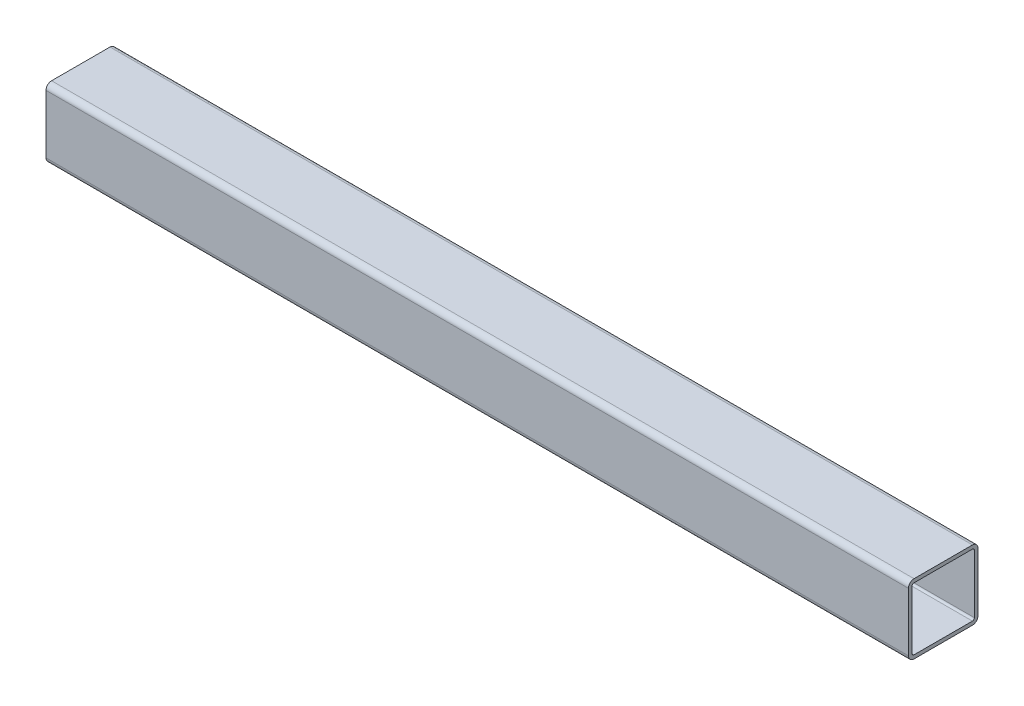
SolidWorks part; units mm, degrees
ref_plane "Front Plane" through (0, 0, 0) normal (0, 0, 1) x (1, 0, 0)
ref_plane "Top Plane" through (0, 0, 0) normal (0, 1, 0) x (1, 0, 0)
ref_plane "Right Plane" through (0, 0, 0) normal (1, 0, 0) x (0, 0, -1)
sketch "Sketch1" plane through (0, 0, 0) normal (1, 0, 0) x (0, 0, -1)
  line L0 (0, 2.54) -> (0, 29.21)
  line L1 (-2.54, 31.75) -> (-29.21, 31.75)
  line L2 (-31.75, 29.21) -> (-31.75, 2.54)
  line L3 (-29.21, 0) -> (-2.54, 0)
  line L4 (-1.651, 2.54) -> (-1.651, 29.21)
  line L5 (-2.54, 30.099) -> (-29.21, 30.099)
  line L6 (-30.099, 29.21) -> (-30.099, 2.54)
  line L7 (-29.21, 1.651) -> (-2.54, 1.651)
  arc A0 (-31.75, 2.54) -> (-29.21, 0) centre (-29.21, 2.54) ccw
  arc A1 (0, 2.54) -> (-2.54, 0) centre (-2.54, 2.54) cw
  arc A2 (0, 29.21) -> (-2.54, 31.75) centre (-2.54, 29.21) ccw
  arc A3 (-31.75, 29.21) -> (-29.21, 31.75) centre (-29.21, 29.21) cw
  arc A4 (-1.651, 29.21) -> (-2.54, 30.099) centre (-2.54, 29.21) ccw
  arc A5 (-30.099, 29.21) -> (-29.21, 30.099) centre (-29.21, 29.21) cw
  arc A6 (-30.099, 2.54) -> (-29.21, 1.651) centre (-29.21, 2.54) ccw
  arc A7 (-1.651, 2.54) -> (-2.54, 1.651) centre (-2.54, 2.54) cw
  point P12 (0, 0)
  point P15 (0, 31.75)
  point P18 (-31.75, 31.75)
  dimension "D3" = 2.54
  dimension "D1" = 31.75
  dimension "D2" = 31.75
  dimension "D4" = 1.651
extrude "Boss-Extrude1" add sketch "Sketch1" along normal blind 393.7
